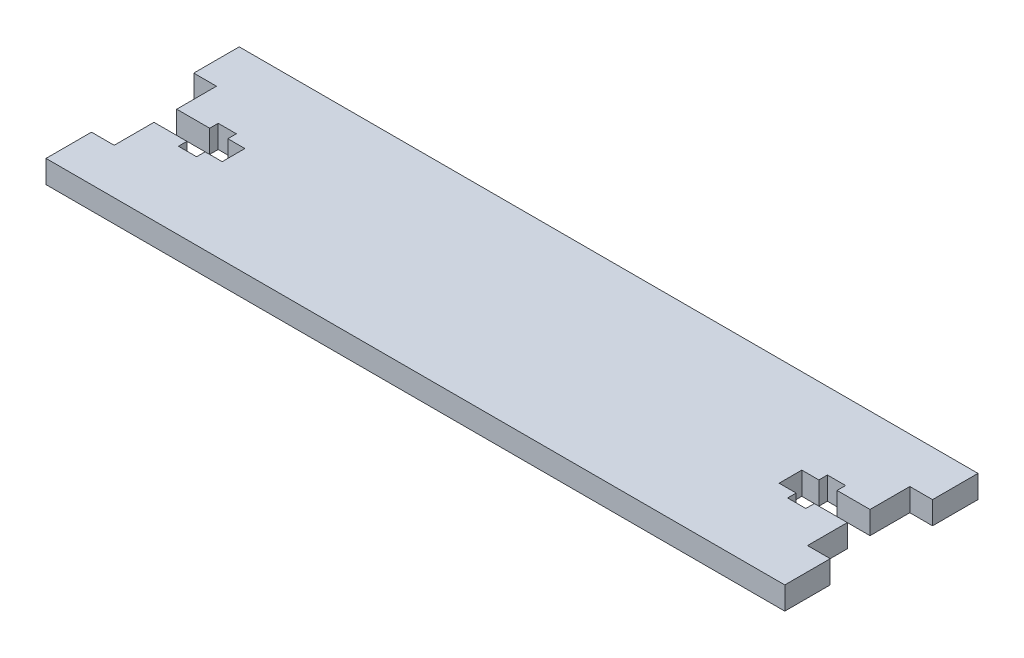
SolidWorks part; units mm, degrees
ref_plane "Ebene vorne" through (0, 0, 0) normal (0, 0, 1) x (1, 0, 0)
ref_plane "Ebene oben" through (0, 0, 0) normal (0, 1, 0) x (1, 0, 0)
ref_plane "Ebene rechts" through (0, 0, 0) normal (1, 0, 0) x (0, 0, -1)
sketch "Skizze2" plane through (0, 0, 0) normal (0, 1, 0) x (1, 0, 0)
  line L0 (-74.6062, 0) -> (112.5525, 0) construction
  line L1 (0, 76.8215) -> (0, -83.6429) construction
  line L2 (-61, 9) -> (-61, 2)
  line L3 (-65, 17) -> (65, 17)
  line L4 (-55.2, -2) -> (-55.2, -3.5)
  line L5 (-61, 2) -> (-55.2, 2)
  line L6 (-65, 17) -> (-65, 9)
  line L7 (-65, 9) -> (-61, 9)
  line L8 (-65, -9) -> (-61, -9)
  line L9 (-65, -17) -> (-65, -9)
  line L10 (65, -17) -> (-65, -17)
  line L11 (65, -17) -> (65, -9)
  line L12 (-61, -2) -> (-55.2, -2)
  line L13 (-49, 2) -> (-49, -2)
  line L14 (-55.2, 3.5) -> (-52, 3.5)
  line L15 (-55.2, 3.5) -> (-55.2, 2)
  line L16 (-55.2, -3.5) -> (-52, -3.5)
  line L17 (-52, 3.5) -> (-52, 2)
  line L18 (-52, -2) -> (-52, -3.5)
  line L19 (-52, 2) -> (-49, 2)
  line L20 (-52, -2) -> (-49, -2)
  line L21 (-61, -2) -> (-61, -9)
  line L22 (65, -9) -> (61, -9)
  line L23 (61, -2) -> (61, -9)
  line L24 (55.2, -2) -> (55.2, -3.5)
  line L25 (61, -2) -> (55.2, -2)
  line L26 (55.2, -3.5) -> (52, -3.5)
  line L27 (52, -2) -> (52, -3.5)
  line L28 (52, -2) -> (49, -2)
  line L29 (52, 2) -> (49, 2)
  line L30 (49, 2) -> (49, -2)
  line L31 (52, 3.5) -> (52, 2)
  line L32 (55.2, 3.5) -> (52, 3.5)
  line L33 (55.2, 3.5) -> (55.2, 2)
  line L34 (61, 2) -> (55.2, 2)
  line L35 (61, 9) -> (61, 2)
  line L36 (65, 9) -> (61, 9)
  line L37 (65, 17) -> (65, 9)
  point P26 (0, -17)
  point P43 (0, 17)
  dimension "D3" = 34
  dimension "D5" = 4
  dimension "D1" = 4
  dimension "D2" = 8
  dimension "D4" = 7
  dimension "D6" = 16
  dimension "D7" = 3
  dimension "D8" = 3.2
  dimension "D9" = 130
extrude "Aufsatz-Linear austragen1" add sketch "Skizze2" along normal blind 4
